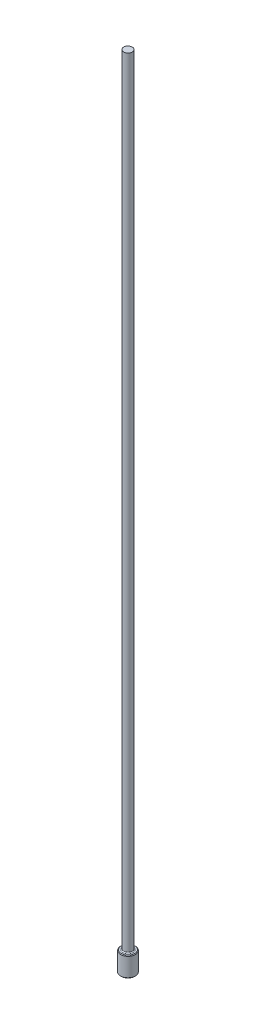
SolidWorks part; units mm, degrees
ref_plane "Front Plane" through (0, 0, 0) normal (0, 0, 1) x (1, 0, 0)
ref_plane "Top Plane" through (0, 0, 0) normal (0, 1, 0) x (1, 0, 0)
ref_plane "Right Plane" through (0, 0, 0) normal (1, 0, 0) x (0, 0, -1)
other "Configuration Table"
sketch "Sketch1" plane through (0, 0, 0) normal (0, 0, 1) x (1, 0, 0)
  line L0 (0, 259.9588) -> (0, -15.1925) construction
  line L1 (0, 0) -> (-0.5842, 0)
  line L2 (-0.5842, 0) -> (-0.5842, 1.5748)
  line L3 (-0.5842, 1.5748) -> (-0.3429, 1.5748)
  line L4 (-0.3429, 1.5748) -> (-0.3429, 63.5)
  line L5 (-0.3429, 63.5) -> (0, 63.5)
  line L6 (0, 63.5) -> (0, 0)
  dimension "L" = 63.5
  dimension "H" = 1.1684
  dimension "T" = 1.5748
  dimension "D" = 0.6858
revolve "Revolve1" add sketch "Sketch1" angle 360 about L0
chamfer "Chamfer1" distance 0.0508 angle 45 2 edges at (0, 1.5748, 0.5842) (0, 0, 0.5842)
fillet "Fillet1" radius 0.0762 1 edges at (0, 1.5748, 0.3429)
